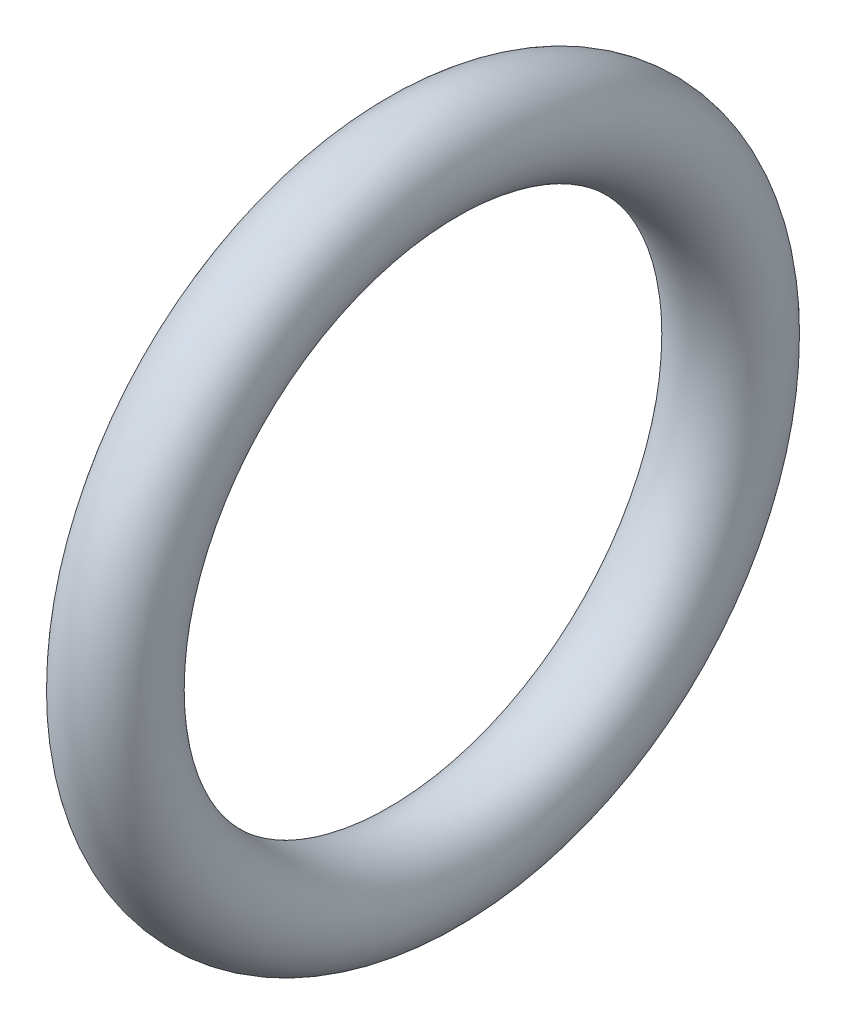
SolidWorks part; units mm, degrees
ref_plane "Plan de face" through (0, 0, 0) normal (0, 0, 1) x (1, 0, 0)
ref_plane "Plan de dessus" through (0, 0, 0) normal (0, 1, 0) x (1, 0, 0)
ref_plane "Plan de droite" through (0, 0, 0) normal (1, 0, 0) x (0, 0, -1)
sketch "Esquisse1" plane through (0, 0, 0) normal (0, 0, 1) x (1, 0, 0)
  line L0 (0, 0) -> (48.9005, 0) construction
  circle A0 centre (0, 6) radius 0.95
  dimension "D1" = 1.9
  dimension "D2" = 6
revolve "Révolution1" add sketch "Esquisse1" angle 360 about L0
